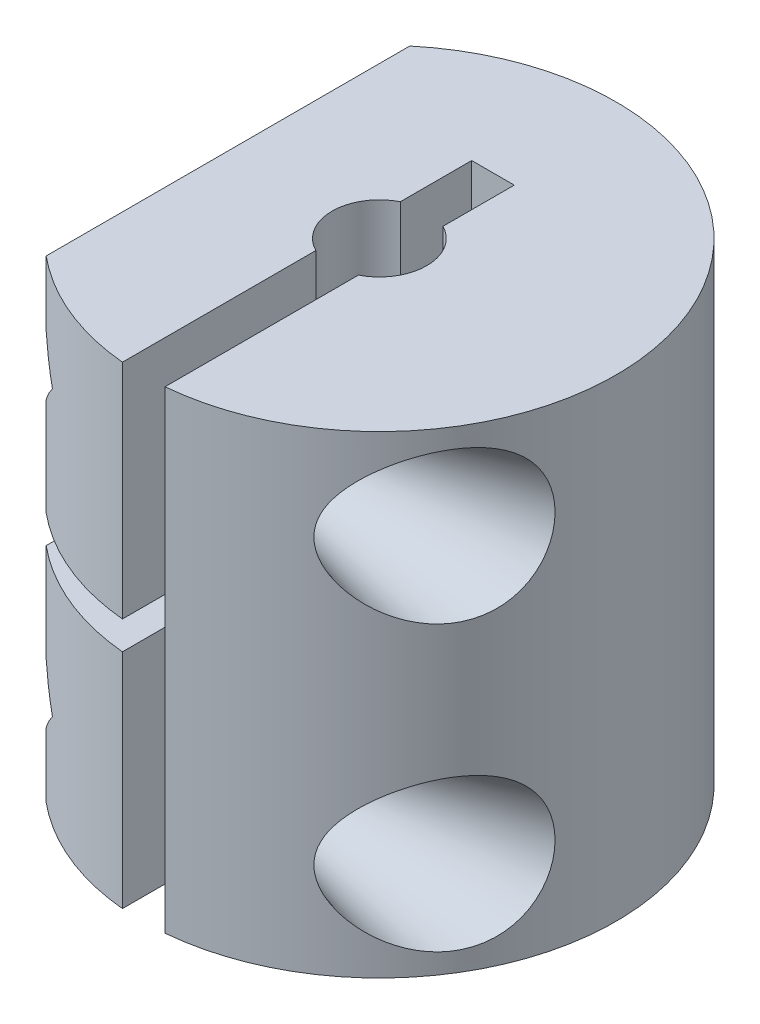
SolidWorks part; units mm, degrees
ref_plane "Front Plane" through (0, 0, 0) normal (0, 0, 1) x (1, 0, 0)
ref_plane "Top Plane" through (0, 0, 0) normal (0, 1, 0) x (1, 0, 0)
ref_plane "Right Plane" through (0, 0, 0) normal (1, 0, 0) x (0, 0, -1)
sketch "Sketch1" plane through (0, 0, 0) normal (0, 1, 0) x (1, 0, 0)
  circle A0 centre (0, 0) radius 12.5
  dimension "D1" = 25
extrude "Boss-Extrude1" add sketch "Sketch1" along normal blind 25
sketch "Sketch2" plane through (0, 25, 0) normal (0, 1, 0) x (1, 0, 0)
  circle A0 centre (0, 0) radius 2.5
  dimension "D1" = 5
extrude "Cut-Extrude1" cut sketch "Sketch2" against normal through all
sketch "Sketch3" plane through (0, 25, 0) normal (0, 1, 0) x (1, 0, 0)
  line L1 (-1.125, 6) -> (1.125, 6)
  line L2 (-1.125, 6) -> (-1.125, -13)
  line L3 (-1.125, -13) -> (1.125, -13)
  line L4 (1.125, 6) -> (1.125, -13)
  point P4 (0, 6)
  dimension "D1" = 19
  dimension "D2" = 2.25
  dimension "D3" = 6
extrude "Cut-Extrude2" cut sketch "Sketch3" against normal through all
sketch "Sketch4" plane through (1.125, 0, 0) normal (-1, 0, 0) x (0, 0, 1)
  line L0 (12.4493, 25) -> (2.2326, 25) construction
  circle A0 centre (7.3409, 20) radius 1.5
  circle A1 centre (7.3409, 5) radius 1.5
  point P6 (7.3409, 25)
  dimension "D1" = 3
  dimension "D2" = 15
  dimension "D3" = 5
extrude "Cut-Extrude3" cut sketch "Sketch4" against normal blind 15 draft 15 and the other way through all
sketch "Sketch11" plane through (1.125, 0, 0) normal (-1, 0, 0) x (0, 0, 1)
  line L0 (-6, 0) -> (-6, 25) construction
  line L1 (-6, 11.75) -> (12.4493, 11.75)
  line L2 (-6, 11.75) -> (-6, 13.25)
  line L3 (-6, 13.25) -> (12.4493, 13.25)
  line L4 (12.4493, 11.75) -> (12.4493, 13.25)
  line L5 (12.4493, 25) -> (12.4493, 0) construction
  point P8 (12.4493, 12.5)
  point P9 (12.4493, 12.5)
  dimension "D1" = 1.5
extrude "Cut-Extrude4" cut sketch "Sketch11" along normal through all
sketch "Sketch12" plane through (0, 25, 0) normal (0, 1, 0) x (1, 0, 0)
  line L0 (-8, 9.6047) -> (-8, -9.6047)
  line L6 (-1.125, -12.4493) -> (-1.125, -2.2326)
  line L7 (-1.125, 2.2326) -> (-1.125, 6)
  line L8 (-1.125, 6) -> (1.125, 6)
  line L9 (1.125, 6) -> (1.125, -2.2326)
  line L15 (1.125, 2.2326) -> (1.125, -12.4493)
  arc A0 (1.125, -12.4493) -> (-1.125, -12.4493) centre (0, 0) ccw construction
  arc A3 (-1.125, 2.2326) -> (-1.125, -2.2326) centre (0, 0) ccw
  arc A4 (1.125, 2.2326) -> (1.125, -2.2326) centre (0, 0) ccw
  arc A5 (1.125, -12.4493) -> (-1.125, -12.4493) centre (0, 0) ccw
  arc A8 (-8, 9.6047) -> (-8, -9.6047) centre (0, 0) ccw
  dimension "D2" = 8
  dimension "D1" = 0
extrude "Cut-Extrude5" cut sketch "Sketch12" against normal through all
sketch "Sketch14" plane through (-8, 0, 0) normal (-1, 0, 0) x (0, 0, 1)
  line L0 (-12.5, 12.5) -> (12.4493, 12.5) construction
  line L7 (4.1655, 20) -> (5.7532, 17.25)
  line L8 (5.7532, 17.25) -> (8.9286, 17.25)
  line L9 (8.9286, 17.25) -> (10.5163, 20)
  line L10 (10.5163, 20) -> (8.9286, 22.75)
  line L11 (8.9286, 22.75) -> (5.7532, 22.75)
  line L12 (5.7532, 22.75) -> (4.1655, 20)
  line L13 (-12.5, 25) -> (-12.5, 0) construction
  line L14 (12.4493, 25) -> (12.4493, 0) construction
  line L15 (5.7532, 2.25) -> (4.1655, 5)
  line L16 (8.9286, 2.25) -> (5.7532, 2.25)
  line L17 (10.5163, 5) -> (8.9286, 2.25)
  line L18 (8.9286, 7.75) -> (10.5163, 5)
  line L19 (5.7532, 7.75) -> (8.9286, 7.75)
  line L20 (4.1655, 5) -> (5.7532, 7.75)
  circle A0 centre (7.3409, 20) radius 2.75 construction
  point P10 (7.3409, 22.75)
  dimension "D1" = 5.5
extrude "Cut-Extrude6" cut sketch "Sketch14" against normal blind 3
